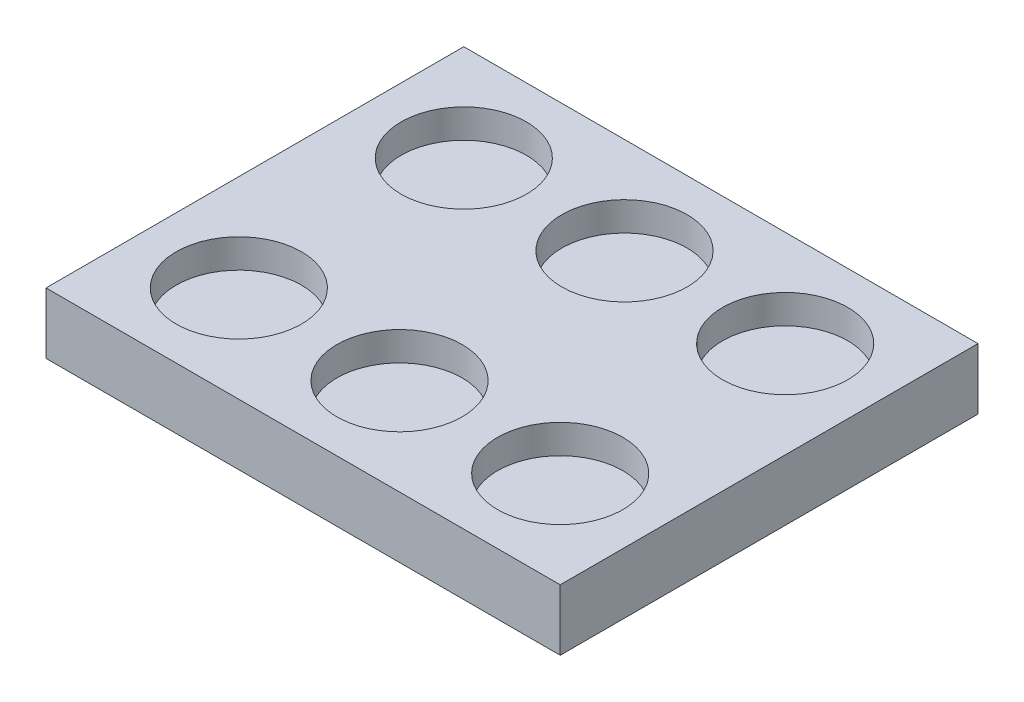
SolidWorks part; units mm, degrees
ref_plane "Front Plane" through (0, 0, 0) normal (0, 0, 1) x (1, 0, 0)
ref_plane "Top Plane" through (0, 0, 0) normal (0, 1, 0) x (1, 0, 0)
ref_plane "Right Plane" through (0, 0, 0) normal (1, 0, 0) x (0, 0, -1)
sketch "Sketch1" plane through (0, 0, 0) normal (0, 1, 0) x (1, 0, 0)
  line L0 (0, 0) -> (6.8897, 0) construction
  line L1 (-17, 13) -> (15, 13)
  line L2 (-17, 13) -> (-17, -13)
  line L3 (-17, -13) -> (15, -13)
  line L4 (15, 13) -> (15, -13)
  circle A0 centre (-11, 7) radius 3.9
  circle A6 centre (-1, 7) radius 3.9
  circle A7 centre (9, 7) radius 3.9
  circle A11 centre (-11, -7) radius 3.9
  circle A12 centre (-1, -7) radius 3.9
  circle A13 centre (9, -7) radius 3.9
  dimension "D5" = 7.8
  dimension "D6" = 7.8
  dimension "D9" = 7.8
  dimension "D1" = 32
  dimension "D2" = 26
  dimension "D3" = 15
  dimension "D4" = 13
  dimension "D7" = 6
  dimension "D8" = 6
  dimension "D10" = 10
  dimension "D11" = 10
  dimension "D12" = 6
  dimension "D13" = 6
extrude "Boss-Extrude1" add sketch "Sketch1" along normal blind 1.8
sketch "Sketch2" plane through (0, 0, 0) normal (0, -1, 0) x (1, 0, 0)
  line L1 (-17, 13) -> (15, 13)
  line L2 (-17, 13) -> (-17, -13)
  line L3 (-17, -13) -> (15, -13)
  line L4 (15, 13) -> (15, -13)
extrude "Boss-Extrude2" add sketch "Sketch2" along normal blind 2
